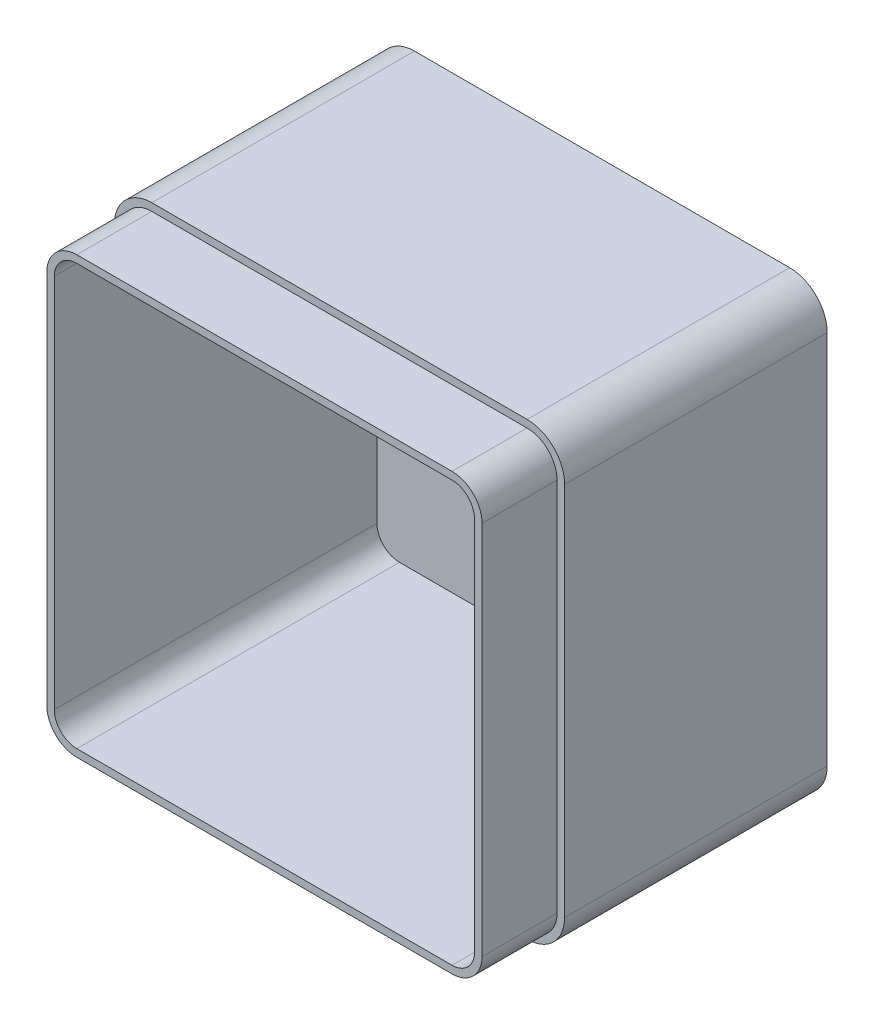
SolidWorks part; units mm, degrees
ref_plane "Front" through (0, 0, 0) normal (0, 0, 1) x (1, 0, 0)
ref_plane "Top" through (0, 0, 0) normal (0, 1, 0) x (1, 0, 0)
ref_plane "Right" through (0, 0, 0) normal (1, 0, 0) x (0, 0, -1)
sketch "Sketch1" plane through (0, 0, 0) normal (0, 0, 1) x (1, 0, 0)
  line L1 (0, 0) -> (120, 0)
  line L2 (0, 0) -> (0, 120)
  line L3 (0, 120) -> (120, 120)
  line L4 (120, 0) -> (120, 120)
  dimension "D1" = 120
  dimension "D2" = 120
extrude "Boss-Extrude3" add sketch "Sketch1" along normal blind 90
fillet "Fillet1" radius 10 4 edges at (0, 0, 45) (120, 0, 45) (120, 120, 45) (0, 120, 45)
shell "Shell1" thickness 4
sketch "Sketch3" plane through (0, 0, 90) normal (0, 0, 1) x (1, 0, 0)
  line L4 (0, 110) -> (0, 10)
  line L5 (10, 0) -> (110, 0)
  line L6 (120, 10) -> (120, 110)
  line L7 (110, 120) -> (10, 120)
  line L8 (0, 110) -> (0, 10)
  line L9 (10, 0) -> (110, 0)
  line L10 (120, 10) -> (120, 110)
  line L11 (110, 120) -> (10, 120)
  line L16 (2, 110) -> (2, 10)
  line L17 (10, 2) -> (110, 2)
  line L18 (118, 10) -> (118, 110)
  line L19 (110, 118) -> (10, 118)
  line L20 (2, 110) -> (2, 10)
  line L21 (10, 2) -> (110, 2)
  line L22 (118, 10) -> (118, 110)
  line L23 (110, 118) -> (10, 118)
  arc A4 (0, 10) -> (10, 0) centre (10, 10) ccw
  arc A5 (110, 0) -> (120, 10) centre (110, 10) ccw
  arc A6 (120, 110) -> (110, 120) centre (110, 110) ccw
  arc A7 (10, 120) -> (0, 110) centre (10, 110) ccw
  arc A8 (0, 10) -> (10, 0) centre (10, 10) ccw
  arc A9 (110, 0) -> (120, 10) centre (110, 10) ccw
  arc A10 (120, 110) -> (110, 120) centre (110, 110) ccw
  arc A11 (10, 120) -> (0, 110) centre (10, 110) ccw
  arc A16 (2, 10) -> (10, 2) centre (10, 10) ccw
  arc A17 (110, 2) -> (118, 10) centre (110, 10) ccw
  arc A18 (118, 110) -> (110, 118) centre (110, 110) ccw
  arc A19 (10, 118) -> (2, 110) centre (10, 110) ccw
  arc A20 (2, 10) -> (10, 2) centre (10, 10) ccw
  arc A21 (110, 2) -> (118, 10) centre (110, 10) ccw
  arc A22 (118, 110) -> (110, 118) centre (110, 110) ccw
  arc A23 (10, 118) -> (2, 110) centre (10, 110) ccw
  dimension "D1" = 0
  dimension "D2" = 2
extrude "Cut-Extrude1" cut sketch "Sketch3" against normal blind 20
